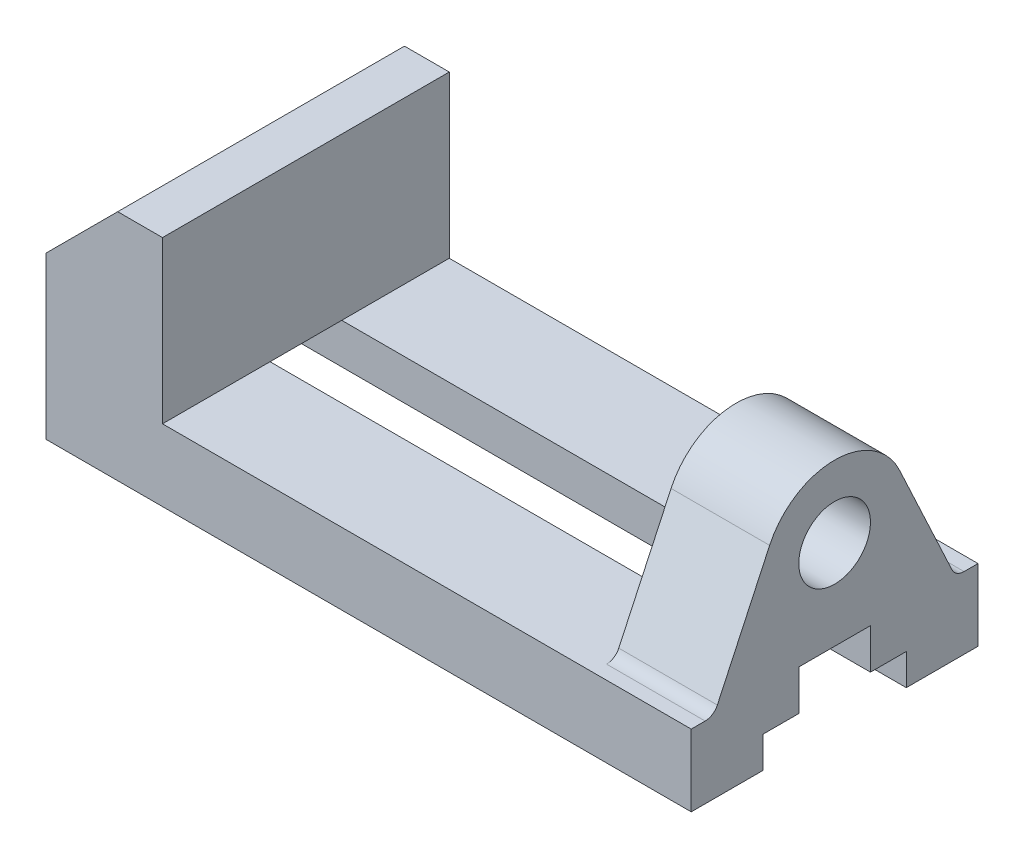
SolidWorks part; units mm, degrees
ref_plane "Front" through (0, 0, 0) normal (0, 0, 1) x (1, 0, 0)
ref_plane "Top" through (0, 0, 0) normal (0, 1, 0) x (1, 0, 0)
ref_plane "Right" through (0, 0, 0) normal (1, 0, 0) x (0, 0, -1)
sketch "Sketch1" plane through (0, 0, 0) normal (0, 0, 1) x (1, 0, 0)
  line L0 (0, 0) -> (144, 0)
  line L1 (144, 0) -> (144, 16)
  line L2 (144, 16) -> (26, 16)
  line L3 (26, 16) -> (26, 52)
  line L4 (26, 52) -> (16, 52)
  line L5 (16, 52) -> (0, 36)
  line L6 (0, 36) -> (0, 0)
  dimension "D1" = 144
  dimension "D2" = 16
  dimension "D3" = 10
  dimension "D4" = 16
  dimension "D5" = 16
  dimension "D6" = 36
extrude "Extrude1" add sketch "Sketch1" along normal mid plane 64
sketch "Sketch2" plane through (144, 0, 0) normal (1, 0, 0) x (0, 0, -1)
  line L0 (14.5009, 42.7619) -> (26.9802, 16)
  line L1 (-32, 52) -> (32, 52) construction
  line L2 (-32, 16) -> (32, 16) construction
  line L3 (0, 52.7641) -> (0, -22.9682) construction
  line L5 (-14.5009, 42.7619) -> (-26.9802, 16)
  line L7 (-26.9802, 16) -> (26.9802, 16)
  arc A1 (14.5009, 42.7619) -> (-14.5009, 42.7619) centre (0, 36) ccw
  dimension "D1" = 16
  dimension "D2" = 50
extrude "Extrude3" add sketch "Sketch2" against normal blind 22
fillet "Fillet1" radius 3
other "Hole1"
sketch "Sketch3" plane through (144, 0, 0) normal (1, 0, 0) x (0, 0, -1)
  circle A0 centre (0, 36) radius 8
  arc A1 (14.5009, 42.7619) -> (-14.5009, 42.7619) centre (0, 36) ccw construction
  dimension "D1" = 16
sketch "Sketch4" plane through (144, 0, 0) normal (1, 0, 0) x (0, 0, -1)
  line L0 (0, 0) -> (0, 54.7774) construction
  line L1 (-16, 0) -> (-16, 7)
  line L2 (-32, 0) -> (32, 0) construction
  line L3 (16, 0) -> (16, 7)
  line L4 (-16, 7) -> (-8, 7)
  line L5 (16, 7) -> (8, 7)
  line L6 (-8, 7) -> (-8, 16)
  line L7 (8, 7) -> (8, 16)
  line L8 (-8, 16) -> (8, 16)
  line L9 (-16, 0) -> (16, 0)
  point P14 (0, 16)
  dimension "D1" = 16
  dimension "D2" = 32
  dimension "D3" = 16
  dimension "D4" = 7
extrude "Cut-Extrude1" cut sketch "Sketch4" against normal through all
ref_plane "Plane1" through (0, 0, 22) normal (0, 0, 1) x (1, 0, 0)
sketch "Sketch6" plane through (0, 0, 22) normal (0, 0, 1) x (1, 0, 0)
  line L0 (106, 26.4839) -> (106, -16.0264) construction
  line L1 (144, 0) -> (144, 16) construction
  line L2 (106, 11.7321) -> (109, 10)
  line L3 (109, 10) -> (109, 0)
  line L4 (0, 0) -> (144, 0) construction
  line L5 (109, 0) -> (106, 0)
  line L6 (106, 0) -> (106, 11.7321)
  dimension "D1" = 38
  dimension "D2" = 6
  dimension "D3" = 10
  dimension "D4" = 60
revolve "Cut-Revolve1" cut sketch "Sketch6" angle 360 about L0
pattern_linear "LPattern2" count 2 spacing 70 count 2 spacing 44
sketch "Sketch7" plane through (0, 16, 0) normal (0, 1, 0) x (-1, 0, 0)
  ellipse E0 centre (-74.8282, 19.0243) end of major axis (-49.5999, 18.4376) minor radius 4.8493
